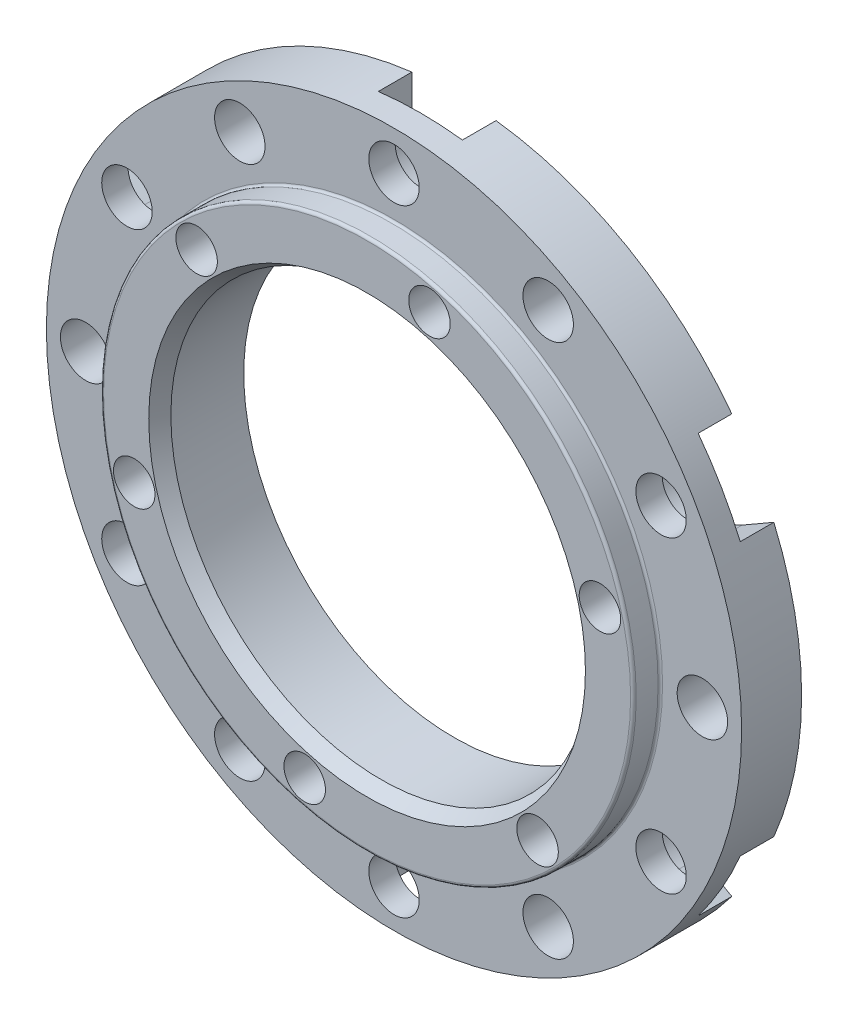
SolidWorks part; units mm, degrees
ref_plane "Plan de face" through (0, 0, 0) normal (0, 0, 1) x (1, 0, 0)
ref_plane "Plan de dessus" through (0, 0, 0) normal (0, 1, 0) x (1, 0, 0)
ref_plane "Plan de droite" through (0, 0, 0) normal (1, 0, 0) x (0, 0, -1)
sketch "Esquisse1" plane through (0, 0, 0) normal (1, 0, 0) x (0, 0, -1)
  line L0 (0.3326, 37.5) -> (0.3326, 47.5)
  line L1 (0.3326, 47.5) -> (5.1326, 47.5)
  line L2 (5.1326, 47.5) -> (5.1326, 62)
  line L3 (5.1326, 62) -> (15.8326, 62)
  line L4 (15.8326, 62) -> (15.8326, 37.5)
  line L5 (-17.5846, 0) -> (50.5694, 0) construction
  line L7 (0.3326, 37.5) -> (15.8326, 37.5)
  dimension "D1" = 75
  dimension "D2" = 124
  dimension "D3" = 4.8
  dimension "D4" = 15.5
  dimension "D5" = 95
revolve "Révolution1" add sketch "Esquisse1" angle 360 about L5
sketch "Esquisse2" plane through (0, 0, -15.8326) normal (0, 0, -1) x (-1, 0, 0)
  line L0 (0, 70.4654) -> (0, -68.9616) construction
  circle A0 centre (0, 0) radius 55 construction
  circle A1 centre (0, 55) radius 4.5
  circle A2 centre (27.5, 47.6314) radius 4.5
  circle A3 centre (47.6314, 27.5) radius 4.5
  circle A4 centre (55, 0) radius 4.5
  circle A5 centre (47.6314, -27.5) radius 4.5
  circle A6 centre (27.5, -47.6314) radius 4.5
  circle A7 centre (0, -55) radius 4.5
  circle A8 centre (-27.5, -47.6314) radius 4.5
  circle A9 centre (-47.6314, -27.5) radius 4.5
  circle A10 centre (-55, 0) radius 4.5
  circle A11 centre (-47.6314, 27.5) radius 4.5
  circle A12 centre (-27.5, 47.6314) radius 4.5
  dimension "D1" = 110
  dimension "D2" = 9
extrude "Extrusion1" cut sketch "Esquisse2" against normal blind 18
sketch "Esquisse3" plane through (0, 0, -15.8326) normal (0, 0, -1) x (-1, 0, 0)
  line L0 (7.5, 61.5447) -> (7.5, 55)
  line L1 (-7.5, 55) -> (-7.5, 61.5447)
  line L2 (-7.5, 61.5447) -> (-7.5, 68.1418)
  line L3 (-7.5, 68.1418) -> (7.5, 68.1418)
  line L4 (7.5, 68.1418) -> (7.5, 61.5447)
  line L5 (43.8814, 33.9952) -> (49.5493, 37.2675)
  line L6 (49.5493, 37.2675) -> (55.2625, 40.5661)
  line L7 (62.7625, 27.5757) -> (57.0493, 24.2772)
  line L8 (57.0493, 24.2772) -> (51.3814, 21.0048)
  line L9 (55.2625, 40.5661) -> (62.7625, 27.5757)
  line L10 (51.3814, -21.0048) -> (57.0493, -24.2772)
  line L11 (57.0493, -24.2772) -> (62.7625, -27.5757)
  line L12 (55.2625, -40.5661) -> (49.5493, -37.2675)
  line L13 (49.5493, -37.2675) -> (43.8814, -33.9952)
  line L14 (62.7625, -27.5757) -> (55.2625, -40.5661)
  line L15 (7.5, -55) -> (7.5, -61.5447)
  line L16 (7.5, -61.5447) -> (7.5, -68.1418)
  line L17 (-7.5, -68.1418) -> (-7.5, -61.5447)
  line L18 (-7.5, -61.5447) -> (-7.5, -55)
  line L19 (7.5, -68.1418) -> (-7.5, -68.1418)
  line L20 (-43.8814, -33.9952) -> (-49.5493, -37.2675)
  line L21 (-49.5493, -37.2675) -> (-55.2625, -40.5661)
  line L22 (-62.7625, -27.5757) -> (-57.0493, -24.2772)
  line L23 (-57.0493, -24.2772) -> (-51.3814, -21.0048)
  line L24 (-55.2625, -40.5661) -> (-62.7625, -27.5757)
  line L25 (-51.3814, 21.0048) -> (-57.0493, 24.2772)
  line L26 (-57.0493, 24.2772) -> (-62.7625, 27.5757)
  line L27 (-55.2625, 40.5661) -> (-49.5493, 37.2675)
  line L28 (-49.5493, 37.2675) -> (-43.8814, 33.9952)
  line L29 (-62.7625, 27.5757) -> (-55.2625, 40.5661)
  circle A0 centre (0, 0) radius 62 construction
  arc A1 (7.5, 55) -> (-7.5, 55) centre (0, 55) cw
  circle A2 centre (0, 55) radius 4.5 construction
  arc A3 (51.3814, 21.0048) -> (43.8814, 33.9952) centre (47.6314, 27.5) cw
  arc A4 (43.8814, -33.9952) -> (51.3814, -21.0048) centre (47.6314, -27.5) cw
  arc A5 (-7.5, -55) -> (7.5, -55) centre (0, -55) cw
  arc A6 (-51.3814, -21.0048) -> (-43.8814, -33.9952) centre (-47.6314, -27.5) cw
  arc A7 (-43.8814, 33.9952) -> (-51.3814, 21.0048) centre (-47.6314, 27.5) cw
  dimension "D1" = 7.5
extrude "Extrusion2" cut sketch "Esquisse3" against normal blind 6
sketch "Esquisse4" plane through (0, 0, -0.3326) normal (0, 0, 1) x (1, 0, 0)
  line L0 (0, 66.6683) -> (0, -68.8348) construction
  line L1 (0, 0) -> (17.7528, 66.2542) construction
  circle A0 centre (0, 0) radius 43 construction
  circle A1 centre (11.1292, 41.5348) radius 3.7027
  circle A2 centre (41.5348, 11.1292) radius 3.7027
  circle A3 centre (30.4056, -30.4056) radius 3.7027
  circle A4 centre (-11.1292, -41.5348) radius 3.7027
  circle A5 centre (-41.5348, -11.1292) radius 3.7027
  circle A6 centre (-30.4056, 30.4056) radius 3.7027
  dimension "D1" = 86
  dimension "D2" = 15
fillet "Congé1" radius 0.4 1 edges at (47.5, 0, -5.1326)
fillet "Congé2" radius 0.5 1 edges at (47.5, 0, -0.3326)
extrude "Extrusion3" cut sketch "Esquisse4" against normal blind 12
chamfer "Chanfrein1" distance 2.5 angle 30 1 edges at (37.5, 0, -0.3326)
